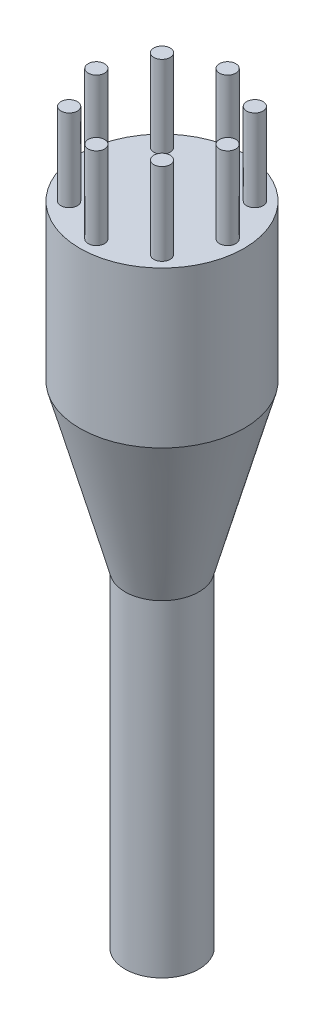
SolidWorks part; units mm, degrees
ref_plane "Front" through (0, 0, 0) normal (0, 0, 1) x (1, 0, 0)
ref_plane "Top" through (0, 0, 0) normal (0, 1, 0) x (1, 0, 0)
ref_plane "Right" through (0, 0, 0) normal (1, 0, 0) x (0, 0, -1)
sketch "Sketch1" plane through (0, 0, 0) normal (1, 0, 0) x (0, 0, -1)
  line L0 (0, 73.4979) -> (0, -93.4936) construction
sketch "Sketch2" plane through (0, 0, 0) normal (0, 1, 0) x (1, 0, 0)
  circle A0 centre (0, 0) radius 10
  dimension "D1" = 20
extrude "Extrude1" add sketch "Sketch2" along normal blind 19
sketch "Sketch5" plane through (0, 19, 0) normal (0, 1, 0) x (-1, 0, 0)
  line L0 (0, 0) -> (0, -13.6278) construction
  circle A0 centre (0, -8) radius 1
  circle A1 centre (0, 0) radius 8 construction
  dimension "D1" = 16
  dimension "D2" = 2
extrude "Extrude4" add sketch "Sketch5" along normal blind 10
pattern_circular "CirPattern1" count 8 over 360 about axis through (0, 0, 0) along (0, 1, 0) of "Extrude4"
sketch "Sketch6" plane through (0, 19, 0) normal (0, 1, 0) x (-1, 0, 0)
  line L0 (0, -8) -> (8, 0) construction
  line L1 (0, 0) -> (4, -4) construction
  circle A0 centre (2, -2) radius 1
  circle A1 centre (0, -8) radius 1 construction
extrude "Extrude5" [suppressed] add sketch "Sketch6" along normal blind 10
sketch "Sketch7" plane through (0, 0, 0) normal (1, 0, 0) x (0, 0, -1)
  line L0 (-10, 19) -> (-10, 0) construction
  line L1 (-10, 0) -> (10, 0) construction
  line L2 (-10, 0) -> (-4.5, -20)
  line L4 (-4.5, -20) -> (-4.5, -59.8168)
  line L5 (-4.5, -59.8168) -> (0, -59.8168)
  line L6 (0, 73.4979) -> (0, -93.4936) construction
  line L7 (-10, 0) -> (0, 0)
  line L8 (0, 0) -> (0, -59.8168)
  dimension "D1" = 4.5
  dimension "D2" = 20
revolve "Revolve1" add sketch "Sketch7" angle 360 about L0
